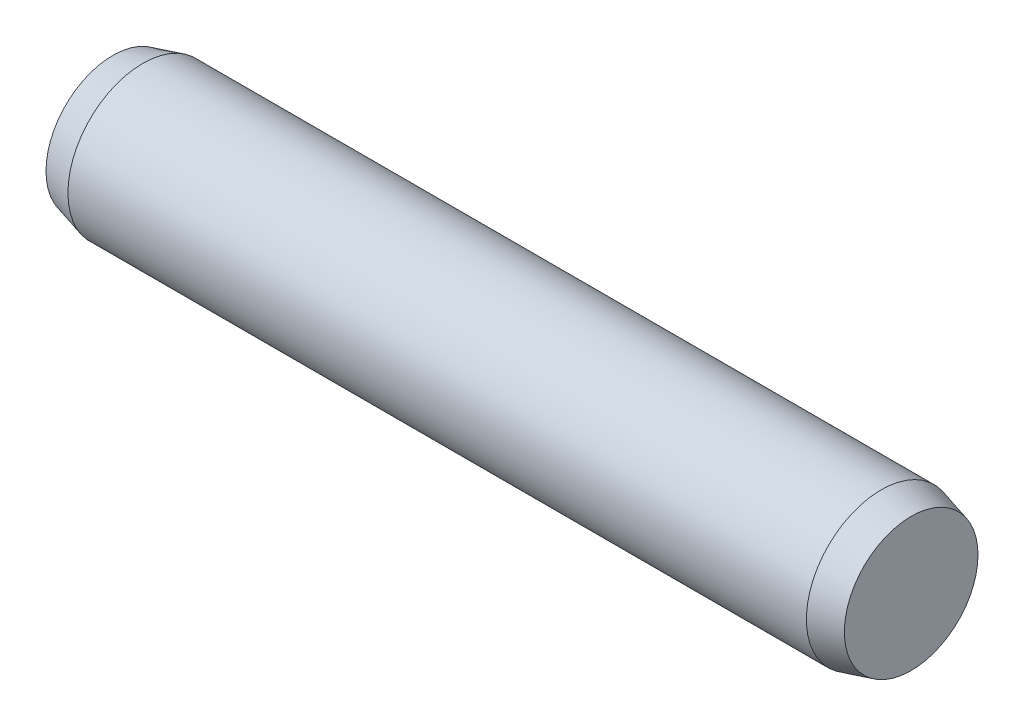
SolidWorks part; units mm, degrees
ref_plane "Front Plane" through (0, 0, 0) normal (0, 0, 1) x (1, 0, 0)
ref_plane "Top Plane" through (0, 0, 0) normal (0, 1, 0) x (1, 0, 0)
ref_plane "Right Plane" through (0, 0, 0) normal (1, 0, 0) x (0, 0, -1)
sketch "Sketch1" plane through (0, 0, 0) normal (0, 0, 1) x (1, 0, 0)
  line L0 (-3.7, 0) -> (3.7, 0) construction
  line L1 (3.7, 0.75) -> (3.7, -0.75) construction
  line L2 (-3.7, 0.75) -> (-3.7, -0.75) construction
  line L3 (4, 0.75) -> (4, -0.75) construction
  line L4 (-4, 0.75) -> (-4, -0.75) construction
  line L5 (-3.7, 0) -> (-4, 0) construction
  line L6 (3.7, 0) -> (4, 0) construction
sketch "Sketch2" plane through (0, 0, 0) normal (1, 0, 0) x (0, 0, -1)
  circle A0 centre (0, 0) radius 0.75
extrude "Extrude1" add sketch "Sketch2" against normal up to vertex (3.7 mm away) and the other way up to vertex (3.7 mm away)
sketch "Sketch3" plane through (3.7, 0, 0) normal (1, 0, 0) x (0, 0, -1)
  circle A1 centre (0, 0) radius 0.75
  circle A2 centre (0, 0) radius 0.75
  dimension "D1" = 0
extrude "Extrude2" add sketch "Sketch3" along normal up to vertex (0.3 mm away) draft 15
sketch "Sketch4" plane through (-3.7, 0, 0) normal (-1, 0, 0) x (0, 0, 1)
  circle A1 centre (0, 0) radius 0.75
  circle A2 centre (0, 0) radius 0.75
  dimension "D1" = 0
extrude "Extrude3" add sketch "Sketch4" along normal up to vertex (0.3 mm away) draft 15
equation "\"D1@Sketch1\" = \"C@Sketch1\""
